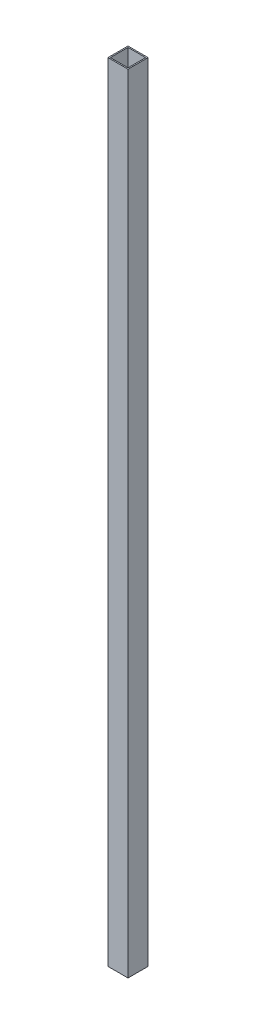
SolidWorks part; units mm, degrees
ref_plane "Plan de face" through (0, 0, 0) normal (0, 0, 1) x (1, 0, 0)
ref_plane "Plan de dessus" through (0, 0, 0) normal (0, 1, 0) x (1, 0, 0)
ref_plane "Plan de droite" through (0, 0, 0) normal (1, 0, 0) x (0, 0, -1)
sketch "Esquisse1" plane through (0, 0, 0) normal (0, 1, 0) x (1, 0, 0)
  line L1 (0, 0) -> (50, 0)
  line L2 (0, 0) -> (0, 50)
  line L3 (0, 50) -> (50, 50)
  line L4 (50, 0) -> (50, 50)
  line L5 (3, 47) -> (47, 47)
  line L6 (3, 47) -> (3, 3)
  line L7 (3, 3) -> (47, 3)
  line L8 (47, 47) -> (47, 3)
  dimension "D1" = 50
  dimension "D2" = 50
  dimension "D3" = 3
  dimension "D4" = 3
  dimension "D5" = 3
  dimension "D6" = 3
extrude "Extrusion1" add sketch "Esquisse1" along normal blind 1960
